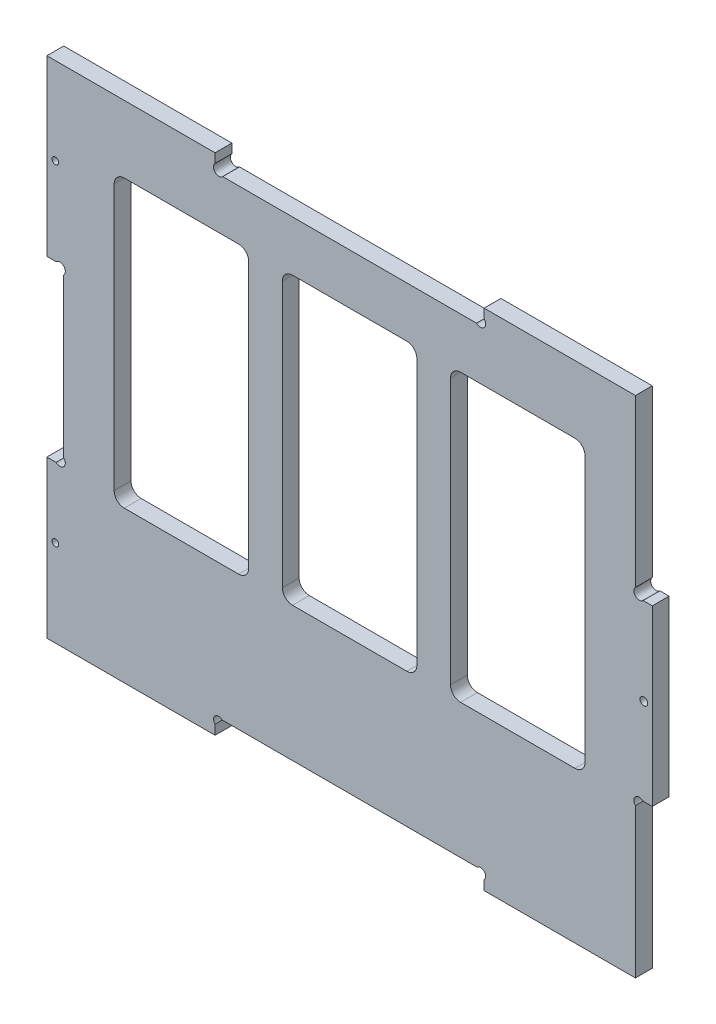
SolidWorks part; units mm, degrees
ref_plane "Plan de face" through (0, 0, 0) normal (0, 0, 1) x (1, 0, 0)
ref_plane "Plan de dessus" through (0, 0, 0) normal (0, 1, 0) x (1, 0, 0)
ref_plane "Plan de droite" through (0, 0, 0) normal (1, 0, 0) x (0, 0, -1)
sketch "Esquisse1" plane through (0, 0, 0) normal (0, 0, 1) x (1, 0, 0)
  line L0 (5, 145) -> (5, 0) construction
  line L1 (52.1213, 0) -> (127.8787, 0)
  line L2 (0, 0) -> (0, 145)
  line L3 (0, 145) -> (180, 145)
  line L4 (180, 0) -> (180, 145)
  line L5 (35, 145) -> (35, 0) construction
  line L6 (40, 145) -> (40, 0) construction
  line L7 (90, 145) -> (90, 0) construction
  line L8 (0, 100) -> (180, 100) construction
  line L9 (0, 105) -> (180, 105) construction
  line L10 (0, 140) -> (180, 140) construction
  line L11 (0, 0) -> (0, -5)
  line L12 (0, -5) -> (50, -5)
  line L13 (50, -5) -> (50, -2.1213)
  line L14 (130, 0) -> (118.0487, -11.9513) construction
  line L16 (175, -5) -> (130, -5)
  line L17 (130, -5) -> (130, -2.1213)
  line L18 (50, 0) -> (69.4165, -19.4165) construction
  line L19 (175, -5) -> (175, 0)
  line L20 (175, 0) -> (180, 0)
  arc A0 (130, -2.1213) -> (127.8787, 0) centre (128.9393, -1.0607) ccw
  arc A1 (52.1213, 0) -> (50, -2.1213) centre (51.0607, -1.0607) ccw
  dimension "D1" = 5
  dimension "D2" = 30
  dimension "D3" = 5
  dimension "D4" = 50
  dimension "D5" = 5
  dimension "D6" = 100
  dimension "D7" = 5
  dimension "D8" = 35
  dimension "D9" = 5
  dimension "D10" = 50
extrude "Boss.-Extru.1" add sketch "Esquisse1" along normal blind 5
sketch "Esquisse2" plane through (0, 0, 5) normal (0, 0, 1) x (1, 0, 0)
  line L0 (0, 145) -> (0, -5) construction
  line L1 (0, 93.3333) -> (5, 93.3333)
  line L2 (0, 93.3333) -> (0, 41.6667)
  line L3 (0, 41.6667) -> (5, 41.6667)
  line L4 (5, 93.3333) -> (5, 41.6667)
  line L5 (180, 145) -> (0, 145) construction
  line L6 (175, 145) -> (180, 145)
  line L7 (175, 145) -> (175, 93.3333)
  line L8 (175, 93.3333) -> (180, 93.3333)
  line L9 (180, 145) -> (180, 93.3333)
  line L10 (180, 0) -> (180, 145) construction
  line L11 (90, 145) -> (90, 112.4125) construction
  line L12 (180, -10) -> (175, -10)
  line L13 (180, -10) -> (180, 41.6667)
  line L14 (180, 41.6667) -> (175, 41.6667)
  line L15 (175, -10) -> (175, 41.6667)
  line L16 (50, 145) -> (130, 145)
  line L17 (50, 145) -> (50, 140)
  line L18 (50, 140) -> (130, 140)
  line L19 (130, 145) -> (130, 140)
  dimension "D1" = 5
  dimension "D2" = 5
  dimension "D3" = 5
  dimension "D4" = 80
extrude "Enlèv. mat.-Extru.1" cut sketch "Esquisse2" against normal through all
sketch "Esquisse3" plane through (0, 0, 5) normal (0, 0, 1) x (1, 0, 0)
  line L0 (50, 140) -> (58.6162, 148.6162) construction
  line L1 (130, 140) -> (116.999, 153.001) construction
  line L2 (5, 93.3333) -> (-9.1547, 79.1786) construction
  line L3 (5, 41.6667) -> (-9.901, 56.5676) construction
  line L4 (175, 93.3333) -> (188.31, 106.6433) construction
  line L5 (175, 41.6667) -> (184.3119, 32.3548) construction
  line L6 (50, 140) -> (130, 140) construction
  line L7 (5, 41.6667) -> (5, 93.3333) construction
  line L8 (175, 145) -> (175, 93.3333) construction
  line L9 (175, 41.6667) -> (175, -5) construction
  circle A0 centre (51.1314, 141.1314) radius 1.6
  circle A1 centre (128.8686, 141.1314) radius 1.6
  circle A2 centre (3.8686, 92.202) radius 1.6
  circle A3 centre (3.8686, 42.798) radius 1.6
  circle A4 centre (176.1314, 94.4647) radius 1.6
  circle A5 centre (176.1314, 40.5353) radius 1.6
  dimension "D1" = 3.2
  dimension "D2" = 45
  dimension "D3" = 45
  dimension "D4" = 45
  dimension "D5" = 45
  dimension "D6" = 45
  dimension "D7" = 45
extrude "Enlèv. mat.-Extru.2" cut sketch "Esquisse3" against normal through all
sketch "Esquisse5" plane through (0, 0, 5) normal (0, 0, 1) x (1, 0, 0)
  line L0 (180, 41.6667) -> (180, 93.3333) construction
  line L1 (177.5, 67.5) -> (191.6973, 67.5) construction
  line L2 (177.2627, 93.3333) -> (180, 93.3333) construction
  line L3 (180, 41.6667) -> (177.2627, 41.6667) construction
  circle A0 centre (177.5, 67.5) radius 1.15
  dimension "D2" = 2.3
  dimension "D1" = 2.5
extrude "Enlèv. mat.-Extru.3" cut sketch "Esquisse5" against normal through all
sketch "Esquisse6" plane through (0, 0, 5) normal (0, 0, 1) x (1, 0, 0)
  line L0 (5, 41.6667) -> (0, 0) construction
  line L1 (5, 93.3333) -> (0, 145) construction
  arc A0 (2.7373, 41.6667) -> (5, 43.9294) centre (3.8686, 42.798) ccw construction
  circle A1 centre (2.5, 20.8333) radius 1
  arc A2 (5, 91.0706) -> (2.7373, 93.3333) centre (3.8686, 92.202) ccw construction
  circle A3 centre (2.5, 119.1667) radius 1
extrude "Enlèv. mat.-Extru.4" cut sketch "Esquisse6" against normal blind 10
sketch "Esquisse7" plane through (0, 0, 5) normal (0, 0, 1) x (1, 0, 0)
  line L0 (20, 125) -> (160, 125) construction
  line L1 (160, 125) -> (160, 15) construction
  line L2 (160, 15) -> (20, 15) construction
  line L3 (20, 15) -> (20, 125) construction
  line L4 (5, 43.9294) -> (5, 91.0706) construction
  line L5 (175, -5) -> (175, 39.4039) construction
  line L6 (52.1213, 0) -> (127.8787, 0) construction
  line L7 (52.2627, 140) -> (127.7373, 140) construction
  line L9 (20, 125) -> (60, 125)
  line L10 (20, 125) -> (20, 40)
  line L11 (20, 40) -> (60, 40)
  line L12 (60, 125) -> (60, 40)
  line L13 (70, 125) -> (110, 125)
  line L14 (70, 125) -> (70, 40)
  line L15 (70, 40) -> (110, 40)
  line L16 (110, 125) -> (110, 40)
  line L17 (120, 125) -> (160, 125)
  line L18 (120, 125) -> (120, 40)
  line L19 (120, 40) -> (160, 40)
  line L20 (160, 125) -> (160, 40)
  dimension "D1" = 15
  dimension "D2" = 15
  dimension "D3" = 15
  dimension "D4" = 15
  dimension "D5" = 10
  dimension "D6" = 10
  dimension "D7" = 85
  dimension "D8" = 85
  dimension "D9" = 85
  dimension "D10" = 40
  dimension "D11" = 40
extrude "Enlèv. mat.-Extru.5" cut sketch "Esquisse7" against normal blind 10
fillet "Congé1" radius 3 12 edges at (160, 40, 2.5) (110, 40, 2.5) (60, 40, 2.5) (20, 40, 2.5) (70, 40, 2.5) (120, 40, 2.5) (160, 125, 2.5) (110, 125, 2.5) (60, 125, 2.5) (120, 125, 2.5) (70, 125, 2.5) (20, 125, 2.5)
